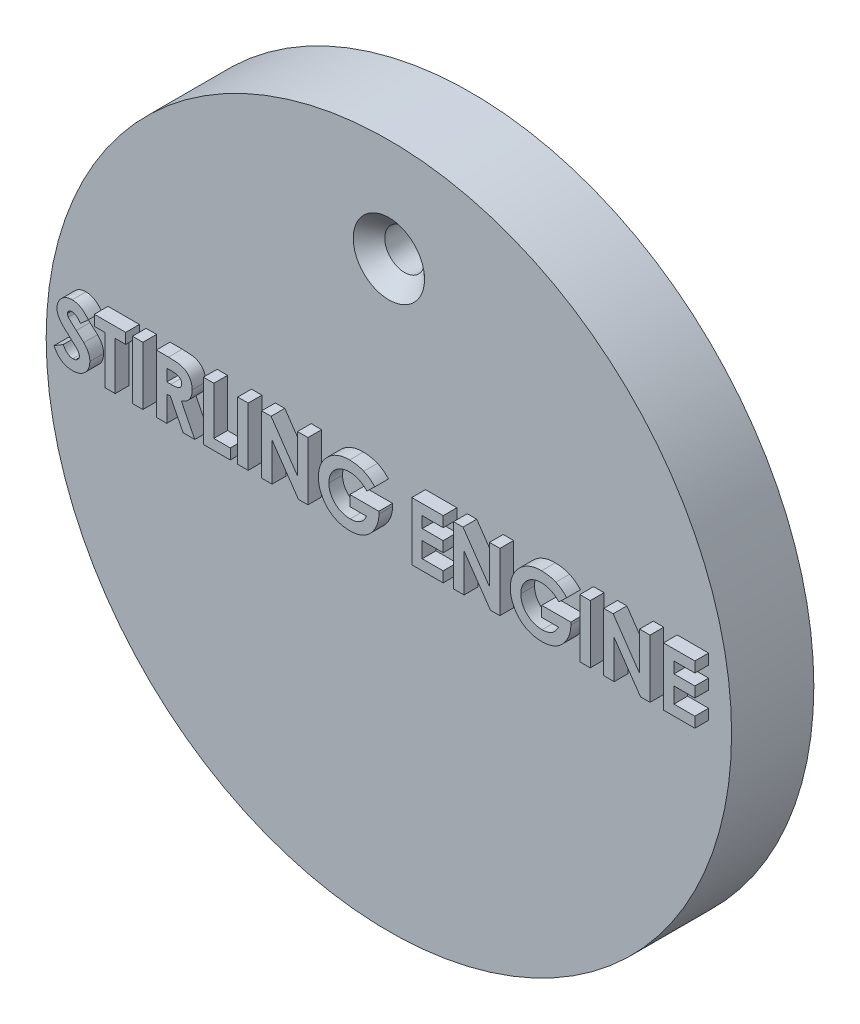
SolidWorks part; units mm, degrees
ref_plane "Front Plane" through (0, 0, 0) normal (0, 0, 1) x (1, 0, 0)
ref_plane "Top Plane" through (0, 0, 0) normal (0, 1, 0) x (1, 0, 0)
ref_plane "Right Plane" through (0, 0, 0) normal (1, 0, 0) x (0, 0, -1)
sketch "Sketch1" plane through (0, 0, 0) normal (0, 0, 1) x (1, 0, 0)
  circle A0 centre (0, 0) radius 50
  dimension "D1" = 100
extrude "Boss-Extrude2" add sketch "Sketch1" along normal blind 12
sketch "Sketch2" plane through (0, 0, 12) normal (0, 0, 1) x (1, 0, 0)
  line L0 (-50, 0) -> (50, 0) construction
  circle A0 centre (0, 0) radius 50 construction
  text T0 "STIRLING ENGINE" font "Century Gothic" height 8.5
extrude "Boss-Extrude3" add sketch "Sketch2" along normal blind 2
hole_wizard "CSK for M5 Flat Head Machine Screw1" positions "Sketch3" profile "Sketch4" countersink size "M5" standard "ANSI Metric"
sketch "Sketch3" plane through (0, 0, 12) normal (0, 0, 1) x (1, 0, 0)
  point P0 (0, 35)
  dimension "D1" = 35
sketch "Sketch4" plane through (0, 35, 12) normal (1, 0, 0) x (0, -1, 0)
  line L0 (0, 0) -> (0, 12)
  line L1 (0, 12) -> (2.9, 12)
  line L2 (2.9, 12) -> (2.9, 2.3)
  line L3 (2.9, 2.3) -> (5.2, 0)
  line L5 (5.2, 0) -> (0, 0)
  line L6 (-2.9, 2.3) -> (-5.2, 0) construction
  line L11 (0, -6.35) -> (0, 107.95) construction
  dimension "Thru Hole Dia." = 5.8
  dimension "Thru Hole Depth" = 12
  dimension "Near C'Sink Dia." = 10.4
  dimension "Near C'Sink Angle" = 90
